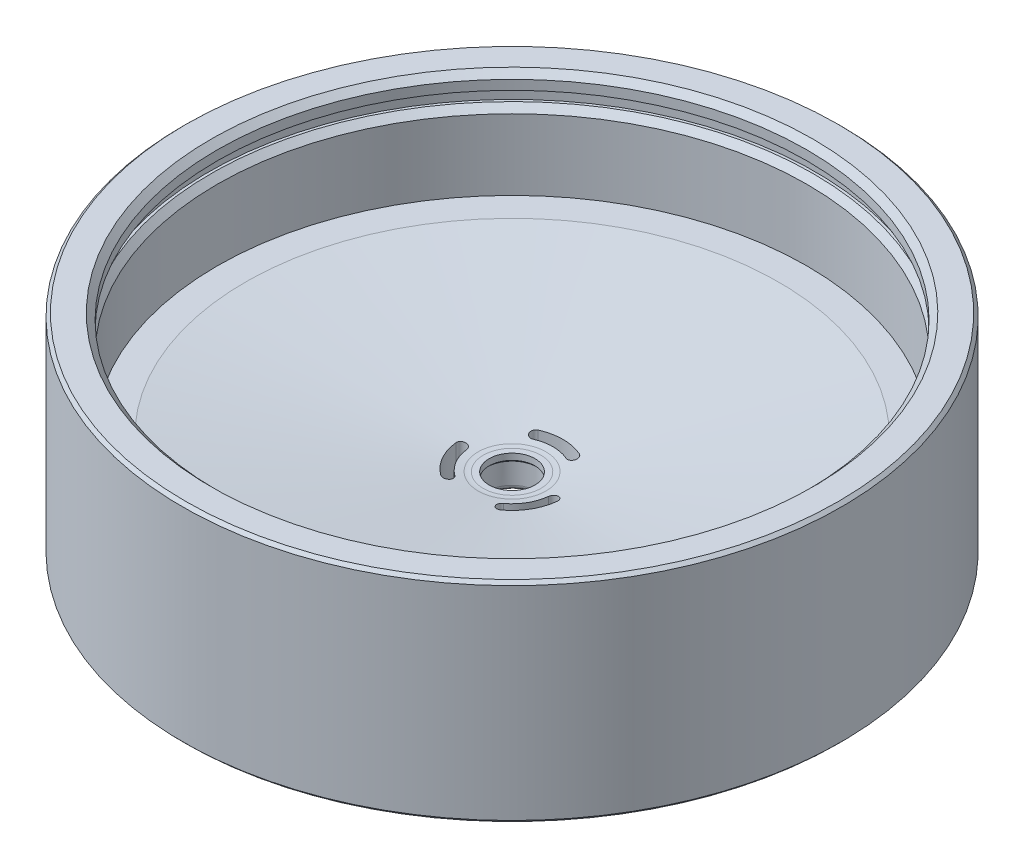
SolidWorks part; units mm, degrees
ref_plane "Front Plane" through (0, 0, 0) normal (0, 0, 1) x (1, 0, 0)
ref_plane "Top Plane" through (0, 0, 0) normal (0, 1, 0) x (1, 0, 0)
ref_plane "Right Plane" through (0, 0, 0) normal (1, 0, 0) x (0, 0, -1)
sketch "Sketch1" plane through (0, 0, 0) normal (0, 0, 1) x (1, 0, 0)
  line L0 (-26.67, 0) -> (-26.67, -16.9672)
  line L1 (-26.67, -16.9672) -> (-25.4, -16.9672)
  line L2 (-15.875, -16.9672) -> (-15.875, -13.9192)
  line L3 (-15.875, -13.9192) -> (-1.8542, -13.9192)
  line L6 (0, 11.0345) -> (0, -32.2285) construction
  line L7 (-26.67, 0) -> (-23.8633, 0)
  line L8 (-23.8633, 0) -> (-23.8633, -8.636)
  line L9 (-23.8633, -8.636) -> (-1.8542, -8.636)
  line L10 (-1.8542, -8.636) -> (-1.8542, -13.9192)
  line L11 (-23.8633, -1.27) -> (-24.5745, -1.27)
  line L12 (-24.5745, -1.27) -> (-24.5745, -2.413)
  line L13 (-24.5745, -2.413) -> (-23.8633, -2.413)
  line L14 (-25.4, -16.9672) -> (-25.4, -13.2842)
  line L15 (-25.4, -13.2842) -> (-17.145, -13.2842)
  line L16 (-17.145, -13.2842) -> (-17.145, -16.9672)
  line L17 (-17.145, -16.9672) -> (-15.875, -16.9672)
  dimension "D1" = 16.9672
  dimension "D2" = 3.048
  dimension "D3" = 3.7084
  dimension "D4" = 31.75
  dimension "D5" = 53.34
  dimension "D6" = 8.636
  dimension "D7" = 2.8067
  dimension "D8" = 49.149
  dimension "D9" = 1.143
  dimension "D10" = 1.27
  dimension "D11" = 34.29
  dimension "D12" = 50.8
  dimension "D13" = 3.683
revolve "Revolve1" add sketch "Sketch1" angle 360 about L6
sketch "Sketch2" plane through (0, -8.636, 0) normal (0, 1, 0) x (1, 0, 0)
  circle A0 centre (0, 0) radius 2.54
  dimension "D1" = 5.08
extrude "Cut-Extrude1" cut sketch "Sketch2" against normal offset from surface (2.4972 mm away) 2.786
sketch "Sketch3" plane through (0, 0, 0) normal (0, 0, 1) x (1, 0, 0)
  line L0 (0, 1.7503) -> (0, -19.0084) construction
  line L5 (1.8542, -11.1332) -> (0, -11.1332)
  line L6 (0, -11.1332) -> (0, -13.9192)
  line L7 (0, -13.9192) -> (2.0447, -13.9192)
  line L8 (-1.8542, -13.9192) -> (1.8542, -13.9192) construction
  line L9 (-15.875, -13.9192) -> (15.875, -13.9192) construction
  line L10 (1.8542, -11.1332) -> (1.8542, -11.6412)
  line L11 (1.8542, -11.6412) -> (2.0447, -11.8317)
  line L12 (2.0447, -11.8317) -> (2.0447, -13.9192)
  line L22 (2.54, -11.1332) -> (-2.54, -11.1332) construction
  dimension "D1" = 0.508
  dimension "D2" = 4.0894
  dimension "D3" = 45
revolve "Cut-Revolve1" cut sketch "Sketch3" angle 360 about L0
sketch "Sketch5" plane through (0, 0, 0) normal (0, 0, 1) x (1, 0, 0)
  line L0 (-21.59, -8.636) -> (-2.54, -11.1332)
  line L1 (-2.54, -11.1332) -> (-2.54, -8.636)
  line L2 (23.8633, -8.636) -> (-23.8633, -8.636) construction
  line L3 (-2.54, -8.636) -> (-21.59, -8.636)
  line L7 (0, 0) -> (0, -27.204) construction
  line L8 (2.54, -11.1332) -> (-2.54, -11.1332) construction
  dimension "D1" = 43.18
revolve "Cut-Revolve2" cut sketch "Sketch5" angle 360 about L7
sketch "Sketch9" plane through (0, -11.1332, 0) normal (0, 1, 0) x (1, 0, 0)
  circle A0 centre (0, 0) radius 2.54 construction
  circle A1 centre (0, 0) radius 2.54
  circle A2 centre (0, 0) radius 3.3147
  dimension "D1" = 6.6294
extrude "Boss-Extrude1" [suppressed] add sketch "Sketch9" along normal up to surface (2.4972 mm away)
fillet "Fillet8" [suppressed] radius 0.6
sketch "Sketch4" plane through (0, -13.9192, 0) normal (0, -1, 0) x (1, 0, 0)
  line L0 (0, 0) -> (-1.4986, -3.406) construction
  line L1 (0, 11.8712) -> (0, -11.289) construction
  line L2 (-7.4717, 0) -> (8.4293, 0) construction
  line L3 (-1.4986, -3.406) -> (1.4986, -3.406) construction
  line L4 (1.4986, -3.406) -> (0, 0) construction
  line L5 (1.3349, -3.034) -> (1.6623, -3.778) construction
  line L6 (-1.3349, -3.034) -> (-1.6623, -3.778) construction
  circle A0 centre (0, 0) radius 4.1275 construction
  arc A8 (-1.3349, -3.034) -> (-1.6623, -3.778) centre (-1.4986, -3.406) ccw
  arc A9 (-1.6623, -3.778) -> (1.6623, -3.778) centre (0, 0) ccw
  arc A10 (1.6623, -3.778) -> (1.3349, -3.034) centre (1.4986, -3.406) ccw
  arc A11 (-1.3349, -3.034) -> (1.3349, -3.034) centre (0, 0) ccw
  circle A12 centre (0, 0) radius 4.1275 construction
  arc A13 (-1.9601, 2.6731) -> (-3.295, 0.3609) centre (0, 0) ccw
  arc A14 (-1.9601, 2.6731) -> (-2.4407, 3.3286) centre (-2.2004, 3.0008) ccw
  arc A15 (-2.4407, 3.3286) -> (-4.103, 0.4494) centre (0, 0) ccw
  arc A16 (-4.103, 0.4494) -> (-3.295, 0.3609) centre (-3.699, 0.4052) ccw
  circle A17 centre (0, 0) radius 4.1275 construction
  arc A18 (3.295, 0.3609) -> (1.9601, 2.6731) centre (0, 0) ccw
  arc A19 (3.295, 0.3609) -> (4.103, 0.4494) centre (3.699, 0.4052) ccw
  arc A20 (4.103, 0.4494) -> (2.4407, 3.3286) centre (0, 0) ccw
  arc A21 (2.4407, 3.3286) -> (1.9601, 2.6731) centre (2.2004, 3.0008) ccw
  point P8 (-1.4986, -3.406)
  point P32 (0, 0)
  point P34 (0, 0)
  dimension "D1" = 8.255
  dimension "D2" = 2.9972
  dimension "D3" = 0.4064
  dimension "D4" = 3
extrude "Cut-Extrude2" cut sketch "Sketch4" against normal through all
sketch "Sketch7" plane through (0, -13.2842, 0) normal (0, -1, 0) x (1, 0, 0)
  line L0 (0, -55) -> (0, 55) construction
  line L1 (3.81, 18.7325) -> (-3.81, 18.7325)
  line L2 (3.81, 18.7325) -> (3.81, 23.8125)
  line L3 (3.81, 23.8125) -> (-3.81, 23.8125)
  line L4 (-3.81, 18.7325) -> (-3.81, 23.8125)
  line L5 (3.81, 18.7325) -> (-3.81, 23.8125) construction
  line L6 (3.81, 23.8125) -> (-3.81, 18.7325) construction
  line L7 (55, 0) -> (-55, 0) construction
  point P0 (0, 21.2725)
  dimension "D1" = 5.08
  dimension "D2" = 7.62
  dimension "D3" = 21.2725
extrude "Cut-Extrude3" cut sketch "Sketch7" against normal blind 1.27
fillet "Fillet3" radius 0.254 12 edges at (1.8726, -13.9192, 3.2411) (3.5745, -13.9192, 2.0637) (3.7432, -13.9192, 0.0012) (1.8706, -13.9192, -3.2423) (0, -13.9192, -4.1275) (-1.8706, -13.9192, -3.2423) (-3.7432, -13.9192, 0.0012) (-3.5745, -13.9192, 2.0637) (-1.8726, -13.9192, 3.2411) (2.8706, -13.9192, 1.6573) (0, -13.9192, -3.3147) (-2.8706, -13.9192, 1.6573)
fillet "Fillet4" radius 0.3962 1 edges at (0, -13.9192, 2.0447)
fillet "Fillet6" radius 1.6002 4 edges at (-3.81, -12.6492, 18.7325) (-3.81, -12.6492, 23.8125) (3.81, -12.6492, 18.7325) (3.81, -12.6492, 23.8125)
chamfer "Chamfer1" distance 0.254 angle 45 2 edges at (0, 0, 26.67) (0, -16.9672, 26.67)
chamfer "Chamfer2" distance 0.5 angle 45 2 edges at (0, -2.413, 23.8633) (0, 0, 23.8633)
fillet "Fillet9" radius 3.2 1 edges at (0, -11.1332, 2.54)
